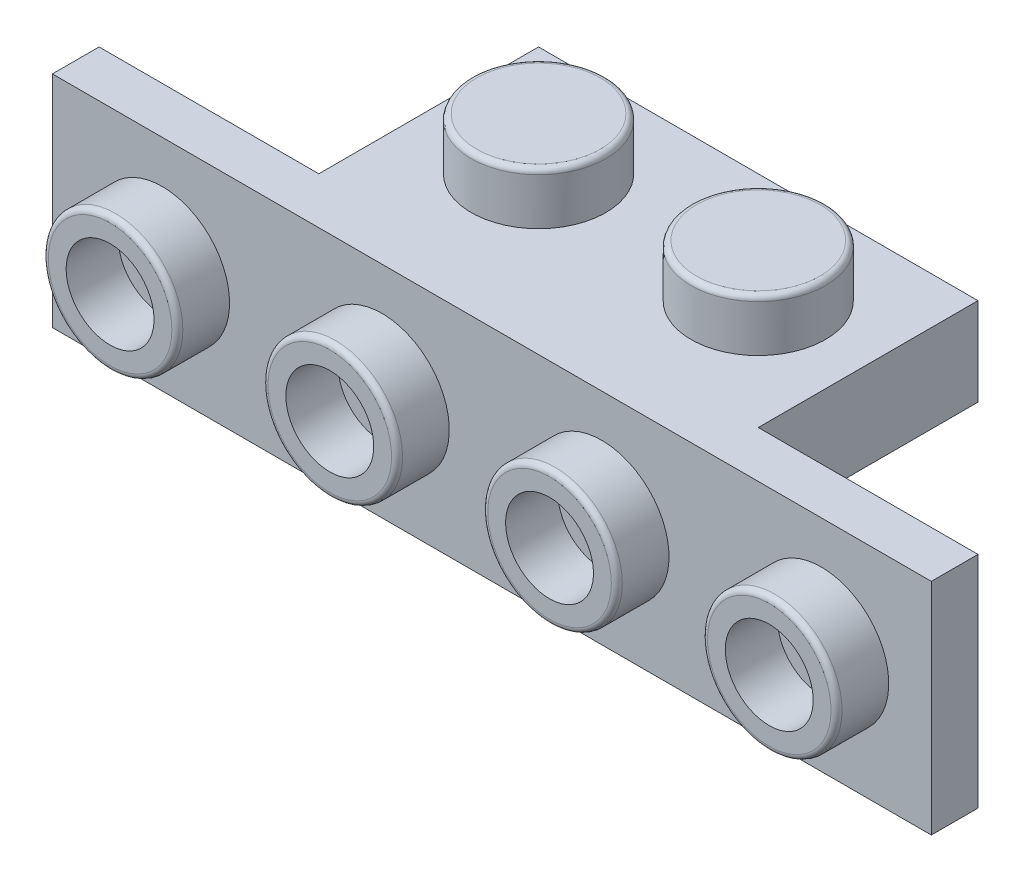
SolidWorks part; units mm, degrees
ref_plane "Vorne" through (0, 0, 0) normal (0, 0, 1) x (1, 0, 0)
ref_plane "Oben" through (0, 0, 0) normal (0, 1, 0) x (1, 0, 0)
ref_plane "Rechts" through (0, 0, 0) normal (1, 0, 0) x (0, 0, -1)
sketch "Skizze1" plane through (0, 0, 0) normal (0, 1, 0) x (1, 0, 0)
  line L1 (0, 0) -> (16, 0)
  line L2 (0, 0) -> (0, 8)
  line L3 (0, 8) -> (16, 8)
  line L4 (16, 0) -> (16, 8)
  dimension "D1" = 16
  dimension "D2" = 8
extrude "Linear austragen1" add sketch "Skizze1" along normal blind 3.2
sketch "Skizze3" plane through (0, 0, 0) normal (0, 0, 1) x (1, 0, 0)
  line L1 (-8, 3.2) -> (24, 3.2)
  line L2 (-8, 3.2) -> (-8, -4.8)
  line L3 (-8, -4.8) -> (24, -4.8)
  line L4 (24, 3.2) -> (24, -4.8)
  line L5 (16, 3.2) -> (16, 0) construction
  dimension "D1" = 32
  dimension "D2" = 8
  dimension "D3" = 8
extrude "Linear austragen2" add sketch "Skizze3" along normal blind 1.7
sketch "Skizze4" plane through (0, 3.2, 0) normal (0, 1, 0) x (-1, 0, 0)
  line L0 (0, -8) -> (0, 0) construction
  line L2 (-16, -8) -> (0, -8) construction
  circle A0 centre (-12, -4) radius 2.45
  circle A1 centre (-4, -4) radius 2.45
  dimension "D5" = 4.9
  dimension "D6" = 4.9
  dimension "D1" = 8
  dimension "D2" = 4
  dimension "D3" = 4
  dimension "D4" = 4
extrude "Linear austragen3" add sketch "Skizze4" along normal blind 1.9
fillet "Verrundung1" radius 0.2 2 edges at (12, 5.1, -1.55) (4, 5.1, -1.55)
sketch "Skizze5" plane through (0, 0, 1.7) normal (0, 0, 1) x (1, 0, 0)
  line L0 (-8, -0.8) -> (24, -0.8) construction
  line L1 (-8, 3.2) -> (-8, -4.8) construction
  line L2 (24, -4.8) -> (24, 3.2) construction
  line L3 (8, 3.2) -> (8, -4.8) construction
  line L4 (24, 3.2) -> (-8, 3.2) construction
  line L5 (-8, -4.8) -> (24, -4.8) construction
  circle A0 centre (-4, -0.8) radius 2.45
  circle A1 centre (4, -0.8) radius 2.45
  circle A2 centre (12, -0.8) radius 2.45
  circle A3 centre (20, -0.8) radius 2.45
  circle A4 centre (-4, -0.8) radius 1.6
  circle A5 centre (4, -0.8) radius 1.6
  circle A6 centre (12, -0.8) radius 1.6
  circle A7 centre (20, -0.8) radius 1.6
  dimension "D1" = 8
  dimension "D5" = 4.9
  dimension "D6" = 3.2
  dimension "D7" = 4.9
  dimension "D8" = 3.2
  dimension "D9" = 4.9
  dimension "D10" = 3.2
  dimension "D11" = 4.9
  dimension "D12" = 3.2
  dimension "D2" = 8
  dimension "D3" = 8
  dimension "D4" = 4
extrude "Linear austragen4" add sketch "Skizze5" along normal blind 1.9
fillet "Verrundung2" radius 0.2 4 edges at (-1.55, -0.8, 3.6) (6.45, -0.8, 3.6) (14.45, -0.8, 3.6) (22.45, -0.8, 3.6)
sketch "Skizze6" plane through (0, 0, 0) normal (0, -1, 0) x (1, 0, 0)
  line L0 (-8, 0) -> (24, 0) construction
  line L1 (14.4, 0) -> (1.6, 0)
  line L2 (14.4, 0) -> (14.4, -6.4)
  line L3 (14.4, -6.4) -> (1.6, -6.4)
  line L4 (1.6, 0) -> (1.6, -6.4)
  line L5 (16, 0) -> (16, -8) construction
  line L6 (0, -8) -> (0, 0) construction
  line L7 (16, -8) -> (0, -8) construction
  dimension "D1" = 1.6
  dimension "D2" = 1.6
  dimension "D3" = 1.6
extrude "Schnitt-Linear austragen1" cut sketch "Skizze6" against normal blind 2.1
sketch "Skizze7" plane through (0, 2.1, 0) normal (0, -1, 0) x (1, 0, 0)
  circle A0 centre (4, -4) radius 1.6
  circle A1 centre (12, -4) radius 1.6
extrude "Schnitt-Linear austragen2" cut sketch "Skizze7" against normal blind 1.8
sketch "Skizze8" plane through (0, 2.1, 0) normal (0, -1, 0) x (1, 0, 0)
  line L0 (16, -8) -> (0, -8) construction
  line L3 (0, -8) -> (0, 0) construction
  circle A2 centre (8, -4.0002) radius 1.6
  circle A3 centre (8, -4.0002) radius 0.8
  dimension "D1" = 3.2
  dimension "D2" = 1.6
  dimension "D3" = 8
  dimension "D4" = 3.9998
extrude "Linear austragen5" add sketch "Skizze8" along normal blind 1.9
sketch "Skizze9" plane through (0, 2.1, 0) normal (0, -1, 0) x (1, 0, 0)
  line L0 (11.9, -2.4031) -> (11.9, 5.3194) construction
  line L1 (3.9, -2.4031) -> (3.9, 4.3274) construction
  line L2 (-8, 0) -> (24, 0) construction
  line L3 (12.55, 0) -> (11.25, 0)
  line L4 (12.55, 0) -> (12.55, -1.6)
  line L5 (12.55, -1.6) -> (11.25, -1.6)
  line L6 (11.25, 0) -> (11.25, -1.6)
  line L8 (4.55, 0) -> (3.25, 0)
  line L9 (4.55, 0) -> (4.55, -1.6)
  line L10 (4.55, -1.6) -> (3.25, -1.6)
  line L11 (3.25, 0) -> (3.25, -1.6)
  circle A0 centre (12, -4) radius 1.6 construction
  circle A1 centre (4, -4) radius 1.6 construction
  dimension "D1" = 1.3
  dimension "D2" = 1.3
  dimension "D3" = 1.6
  dimension "D4" = 1.6
  dimension "D5" = 0.65
  dimension "D6" = 0.65
extrude "Linear austragen6" add sketch "Skizze9" along normal blind 1.9
chamfer "Fase1" distance 0.5 angle 45 3 edges at (7.9, 2.1, 0) (2.425, 2.1, 0) (13.475, 2.1, 0)
